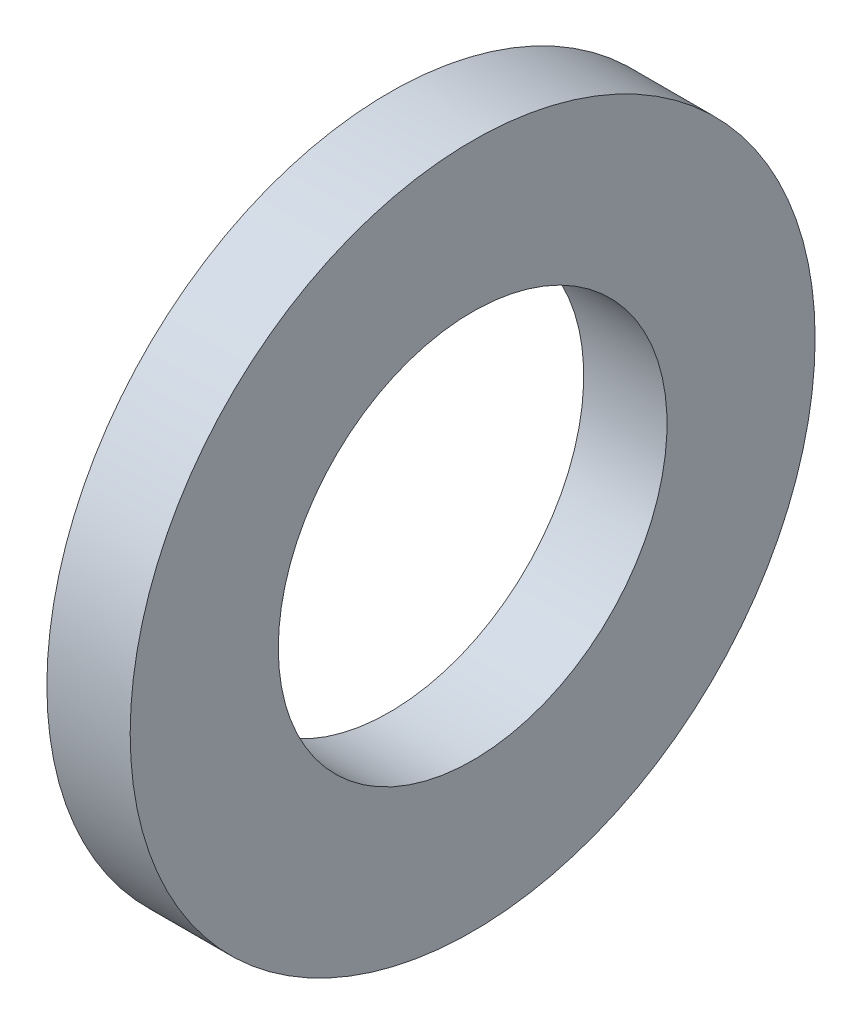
SolidWorks part; units mm, degrees
ref_plane "Plane1" through (0, 0, 0) normal (0, 0, 1) x (1, 0, 0)
ref_plane "Plane2" through (0, 0, 0) normal (0, 1, 0) x (1, 0, 0)
ref_plane "Plane3" through (0, 0, 0) normal (1, 0, 0) x (0, 0, -1)
other "Configuration Table"
sketch "Sketch1" plane through (0, 0, 0) normal (0, 0, 1) x (1, 0, 0)
  line L0 (-34.925, 0) -> (9.525, 0) construction
  line L1 (0, 10.5) -> (0, 18.5)
  line L2 (0, 18.5) -> (-4.5, 18.5)
  line L3 (-4.5, 18.5) -> (-4.5, 10.5)
  line L4 (-4.5, 10.5) -> (0, 10.5)
  dimension "Thickness" = 4.5
  dimension "Inside_dia" = 21
  dimension "Outside_dia" = 37
revolve "Base-Revolve" add sketch "Sketch1" angle 360 about L0
